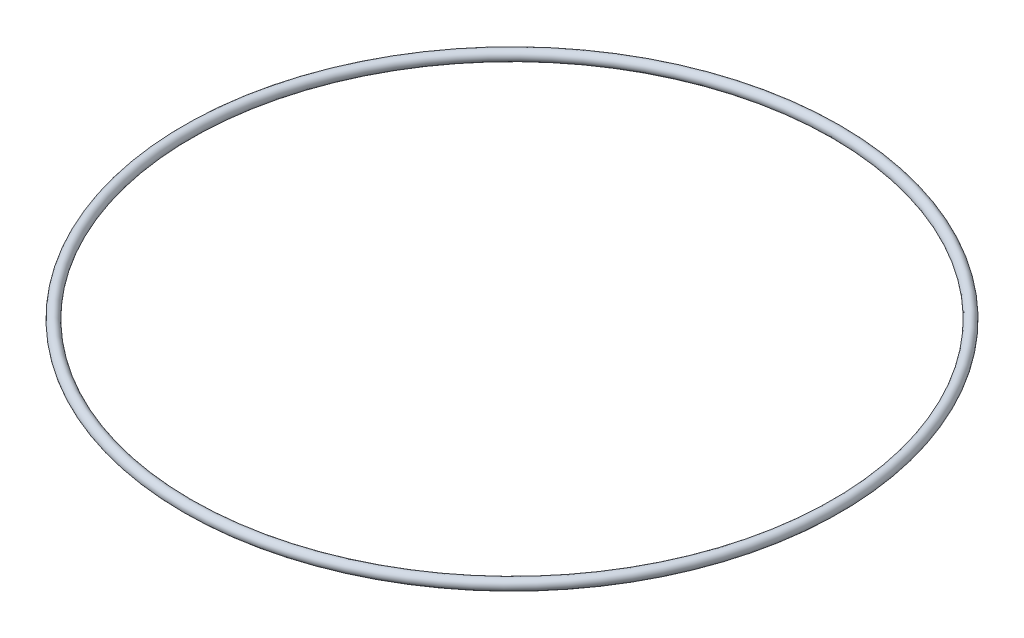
SolidWorks part; units mm, degrees
ref_plane "Plan1" through (0, 0, 0) normal (0, 0, 1) x (1, 0, 0)
ref_plane "Plan2" through (0, 0, 0) normal (0, 1, 0) x (1, 0, 0)
ref_plane "Plan3" through (0, 0, 0) normal (1, 0, 0) x (0, 0, -1)
sketch "Esquisse1" plane through (0, 0, 0) normal (0, 0, 1) x (1, 0, 0)
  line L1 (0, 0) -> (182, 0) construction
  line L2 (0, 1.5) -> (0, -1.5) construction
  circle A0 centre (92.5, 0) radius 1.5
  dimension "D2" = 92.5
  dimension "D1" = 3
  dimension "Diamètre du tore" = 3
  dimension "Diamètre intérieur" = 182
revolve "Base-Révolution" add sketch "Esquisse1" angle 360 about L2
equation " \"D1@Esquisse1\"=\"Diamètre du tore@Esquisse1\" "
equation "\"D2@Esquisse1\" = (\"Diamètre intérieur@Esquisse1\"/2)+(\"Diamètre du tore@Esquisse1\"/2)"
